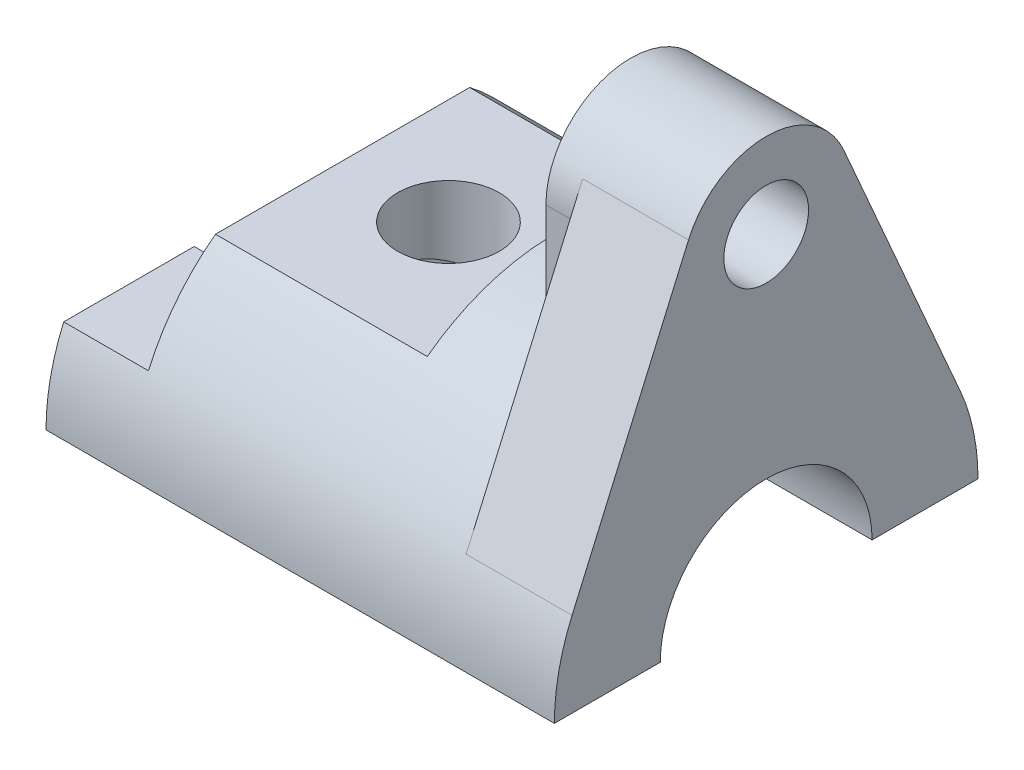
SolidWorks part; units mm, degrees
ref_plane "前视基准面" through (0, 0, 0) normal (0, 0, 1) x (1, 0, 0)
ref_plane "上视基准面" through (0, 0, 0) normal (0, 1, 0) x (1, 0, 0)
ref_plane "右视基准面" through (0, 0, 0) normal (1, 0, 0) x (0, 0, -1)
sketch "草图1" plane through (0, 0, 0) normal (1, 0, 0) x (0, 0, -1)
  line L0 (-50, 0) -> (-25, 0)
  line L1 (25, 0) -> (50, 0)
  arc A0 (50, 0) -> (-50, 0) centre (0, 0) ccw
  arc A1 (25, 0) -> (-25, 0) centre (0, 0) ccw
extrude "拉伸1" add sketch "草图1" against normal blind 120
sketch "草图2" plane through (0, 0, 0) normal (1, 0, 0) x (0, 0, -1)
  line L0 (0, 0) -> (0, 75) construction
  line L1 (-18.3303, 83) -> (-45.8258, 20)
  line L2 (18.3303, 83) -> (45.8258, 20)
  arc A0 (18.3303, 83) -> (-18.3303, 83) centre (0, 75) ccw
  circle A1 centre (0, 75) radius 10
  arc A2 (50, 0) -> (-50, 0) centre (0, 0) ccw construction
  arc A3 (45.8258, 20) -> (-45.8258, 20) centre (0, 0) ccw
  dimension "D1" = 40
extrude "拉伸2" add sketch "草图2" against normal blind 25
sketch "草图3" plane through (-25, 0, 0) normal (-1, 0, 0) x (0, 0, 1)
  line L0 (20, 75) -> (20, 45.8258)
  line L1 (-20, 75) -> (-20, 45.8258)
  arc A0 (20, 75) -> (-20, 75) centre (0, 75) ccw
  arc A1 (45.8258, 20) -> (-45.8258, 20) centre (0, 0) ccw construction
  arc A2 (50, 0) -> (-50, 0) centre (0, 0) ccw construction
  arc A3 (20, 45.8258) -> (-20, 45.8258) centre (0, 0) ccw
  circle A4 centre (0, 75) radius 10
extrude "拉伸3" add sketch "草图3" along normal blind 7
sketch "草图4" plane through (-120, 0, 0) normal (-1, 0, 0) x (0, 0, 1)
  line L0 (56.3284, 20) -> (56.3284, 52.4067)
  line L1 (-58.6836, 20) -> (56.3284, 20)
  line L2 (56.3284, 52.4067) -> (-58.6836, 52.4067)
  line L3 (-58.6836, 52.4067) -> (-58.6836, 20)
extrude "切除-拉伸1" cut sketch "草图4" against normal blind 20
sketch "草图5" plane through (-100, 0, 0) normal (-1, 0, 0) x (0, 0, 1)
  line L1 (-60.2537, 40) -> (57.7023, 40)
  line L2 (-60.2537, 40) -> (-60.2537, 65.5565)
  line L3 (-60.2537, 65.5565) -> (57.7023, 65.5565)
  line L4 (57.7023, 40) -> (57.7023, 65.5565)
extrude "切除-拉伸2" cut sketch "草图5" against normal blind 50
sketch "草图6" plane through (0, 40, 0) normal (0, 1, 0) x (1, 0, 0)
  line L0 (-75, -58.0535) -> (-75, 46.6907) construction
  line L1 (-100, 15) -> (-100, -15) construction
  circle A0 centre (-75, 0) radius 12
  point P2 (-100, 0)
  dimension "D1" = 25
extrude "切除-拉伸3" cut sketch "草图6" against normal through all
